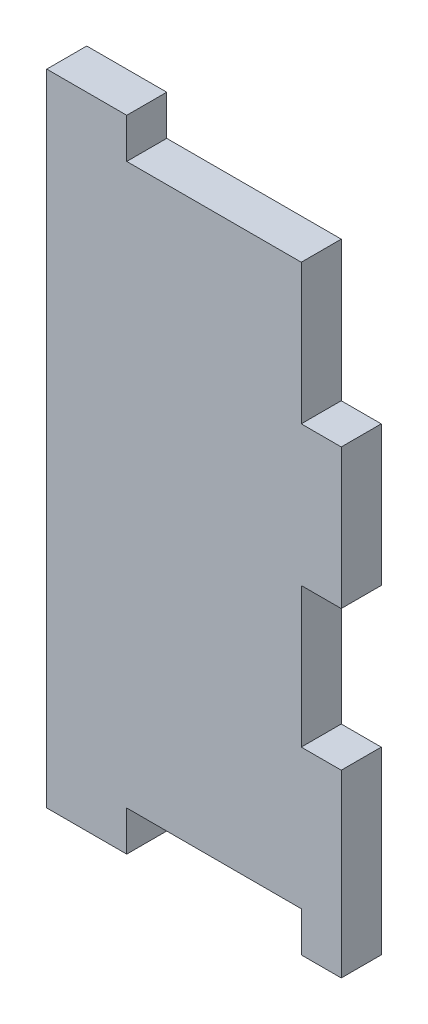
SolidWorks part; units mm, degrees
ref_plane "Front Plane" through (0, 0, 0) normal (0, 0, 1) x (1, 0, 0)
ref_plane "Top Plane" through (0, 0, 0) normal (0, 1, 0) x (1, 0, 0)
ref_plane "Right Plane" through (0, 0, 0) normal (1, 0, 0) x (0, 0, -1)
sketch "Sketch1" plane through (0, 0, 0) normal (0, 0, 1) x (1, 0, 0)
  line L0 (23.3807, 50.8) -> (17.0307, 50.8)
  line L1 (17.0307, 50.8) -> (17.0307, 44.45)
  line L2 (17.0307, 44.45) -> (-10.6807, 44.45)
  line L3 (-10.6807, 44.45) -> (-10.6807, 50.8)
  line L4 (-10.6807, 50.8) -> (-23.3807, 50.8)
  line L5 (-23.3807, 50.8) -> (-23.3807, -50.8)
  line L6 (-23.3807, -50.8) -> (-10.6807, -50.8)
  line L7 (-10.6807, -50.8) -> (-10.6807, -44.45)
  line L8 (-10.6807, -44.45) -> (17.0307, -44.45)
  line L9 (17.0307, -44.45) -> (17.0307, -50.8)
  line L10 (17.0307, -50.8) -> (23.3807, -50.8)
  line L11 (23.3807, -50.8) -> (23.3807, 50.8)
  line L12 (23.3807, -50.8) -> (-23.3807, 50.8) construction
  line L17 (17.0307, 44.45) -> (17.0307, -44.45) construction
  line L18 (-10.6807, -44.45) -> (-23.3807, -44.45) construction
  line L19 (-23.3807, -44.45) -> (17.0307, 44.45) construction
  point P16 (0, 0)
  dimension "D1" = 101.6
  dimension "D2" = 6.35
  dimension "D3" = 12.7
  dimension "D5" = 46.7614
extrude "Boss-Extrude1" add sketch "Sketch1" along normal blind 6.35
sketch "Sketch2" plane through (0, 0, 6.35) normal (0, 0, 1) x (1, 0, 0)
  line L0 (23.3807, -50.8) -> (23.3807, 50.8) construction
  line L1 (17.0307, 50.8) -> (23.3807, 50.8)
  line L2 (17.0307, 50.8) -> (17.0307, 22.225)
  line L3 (17.0307, 22.225) -> (23.3807, 22.225)
  line L4 (23.3807, 50.8) -> (23.3807, 22.225)
  line L5 (17.0307, 44.45) -> (23.3807, 44.45) construction
  line L6 (23.3807, 0) -> (17.0307, 0)
  line L7 (23.3807, 0) -> (23.3807, -22.225)
  line L8 (23.3807, -22.225) -> (17.0307, -22.225)
  line L9 (17.0307, 0) -> (17.0307, -22.225)
  line L10 (20.2057, 44.45) -> (20.2057, 22.225) construction
  line L11 (20.2057, 22.225) -> (20.2057, 0) construction
  line L12 (17.0307, -44.45) -> (23.3807, -44.45) construction
  line L13 (20.2057, -22.225) -> (20.2057, -44.45) construction
extrude "Cut-Extrude1" cut sketch "Sketch2" against normal through all
sketch "Sketch3" [suppressed] plane through (0, 0, 6.35) normal (0, 0, 1) x (1, 0, 0)
  line L0 (23.3807, -38.1) -> (23.3807, 38.1) construction
  line L1 (23.3807, -38.1) -> (17.0307, -38.1)
  line L2 (23.3807, -38.1) -> (23.3807, -15.875)
  line L3 (23.3807, -15.875) -> (17.0307, -15.875)
  line L4 (17.0307, -38.1) -> (17.0307, -15.875)
  line L5 (23.3807, 0) -> (17.0307, 0)
  line L6 (23.3807, 0) -> (23.3807, 15.875)
  line L7 (23.3807, 15.875) -> (17.0307, 15.875)
  line L8 (17.0307, 0) -> (17.0307, 15.875)
  line L9 (20.2057, 0) -> (20.2057, -15.875) construction
  line L10 (20.2057, -15.875) -> (20.2057, -31.75) construction
  line L11 (20.2057, -31.75) -> (17.0307, -31.75) construction
  line L12 (17.0307, 31.75) -> (23.3807, 31.75) construction
  line L13 (20.2057, 31.75) -> (20.2057, 15.875) construction
extrude "Cut-Extrude2" [suppressed] cut sketch "Sketch3" against normal through all
equation "\"PlywoodThickness\"= .25in"
equation "\"D2@Sketch1\"=\"PlywoodThickness\""
equation "\"D3@Sketch1\"=\"PlywoodThickness\"*2"
